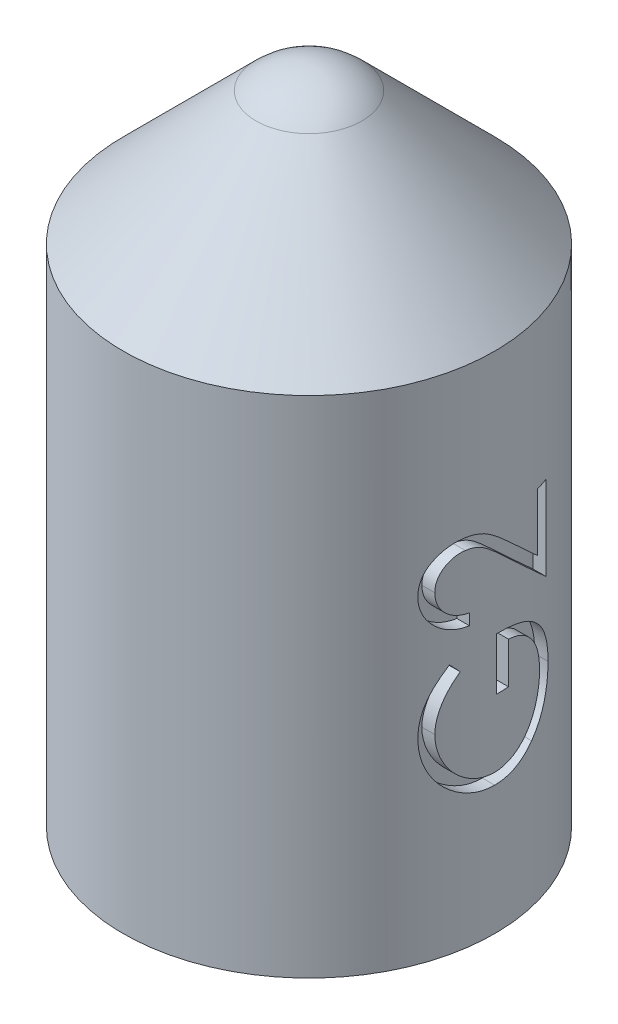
SolidWorks part; units mm, degrees
ref_plane "Plan de face" through (0, 0, 0) normal (0, 0, 1) x (1, 0, 0)
ref_plane "Plan de dessus" through (0, 0, 0) normal (0, 1, 0) x (1, 0, 0)
ref_plane "Plan de droite" through (0, 0, 0) normal (1, 0, 0) x (0, 0, -1)
sketch "Esquisse1" plane through (0, 0, 0) normal (0, 0, 1) x (1, 0, 0)
  line L0 (0, 0) -> (0, 61.7034) construction
  line L1 (-1.5, 4.25) -> (-1.5, 0.1754)
  line L2 (-1.5, 4.25) -> (0, 5.75) construction
  line L3 (-1, 4.75) -> (0, 4.75) construction
  line L4 (0, 0) -> (0, 5.5)
  line L5 (-1.5, 4.25) -> (-0.4268, 5.3232)
  arc A0 (-1.5, 0.1754) -> (0, 0) centre (0, 6.5) ccw
  arc A1 (0, 5.5) -> (-0.4268, 5.3232) centre (0, 4.8964) ccw
  dimension "D2" = 13
  dimension "D1" = 3
  dimension "D3" = 45
  dimension "D4" = 2
  dimension "D5" = 1.75
  dimension "D6" = 0.25
revolve "Révolution1" add sketch "Esquisse1" angle 360 about L0
ref_plane "Plan1" through (1.5, 0, 0) normal (1, 0, 0) x (0, 0, -1)
sketch "Esquisse2" plane through (1.5, 0, 0) normal (1, 0, 0) x (0, 0, -1)
  line L0 (0.5, 4.25) -> (0.5, 0) construction
  line L1 (-1.5, 4.25) -> (1.5, 4.25) construction
  text T0 "G2" font "Century Gothic" height 1
  dimension "D1" = 0.5
extrude "Enlèv. mat.-Extru.1" cut sketch "Esquisse2" against normal offset from surface (0.1174 mm away) 0.1
ref_plane "Plan2" through (-1.5, 0, 0) normal (-1, 0, 0) x (0, 0, 1)
sketch "Esquisse3" plane through (-1.5, 0, 0) normal (-1, 0, 0) x (0, 0, 1)
  line L0 (0.5, 4.25) -> (0.5, -0.0003) construction
  line L1 (-1.5, 4.25) -> (1.5, 4.25) construction
  text T0 "G2" font "Century Gothic" height 1
  dimension "D1" = 0.5
extrude "Enlèv. mat.-Extru.2" cut sketch "Esquisse3" against normal offset from surface (0.1174 mm away) 0.1
